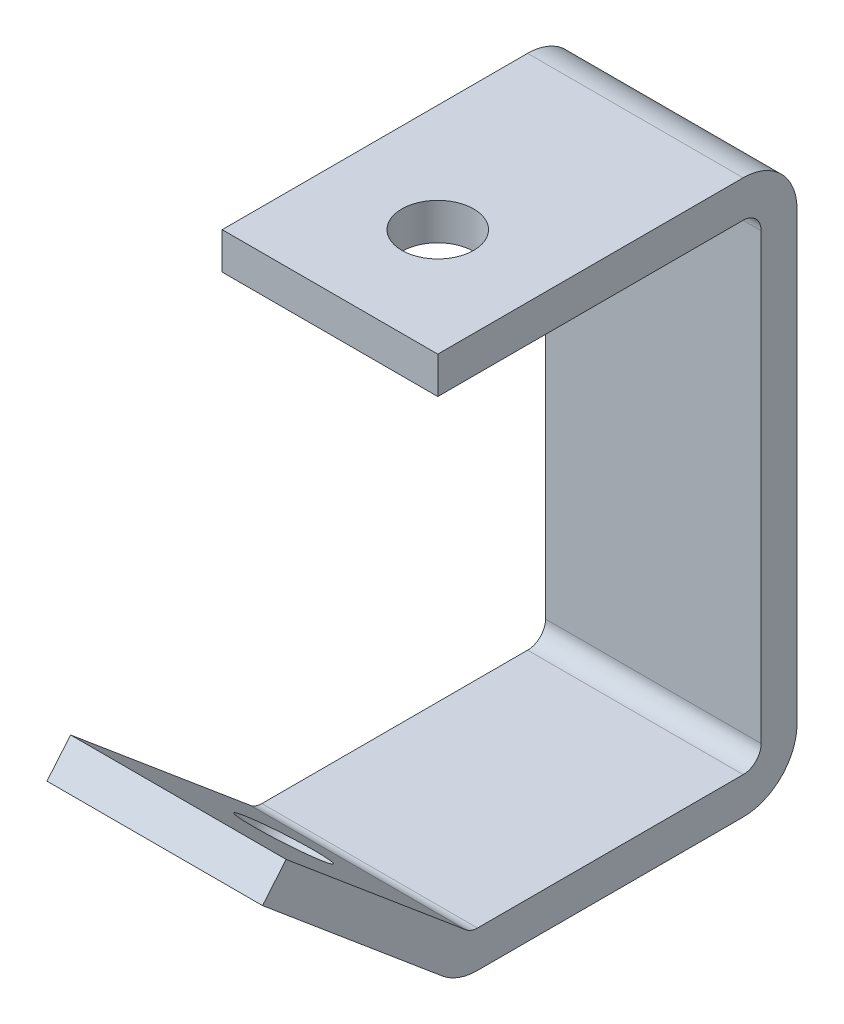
SolidWorks part; units mm, degrees
ref_plane "Ebene vorne" through (0, 0, 0) normal (0, 0, 1) x (1, 0, 0)
ref_plane "Ebene oben" through (0, 0, 0) normal (0, 1, 0) x (1, 0, 0)
ref_plane "Ebene rechts" through (0, 0, 0) normal (1, 0, 0) x (0, 0, -1)
ref_plane "Ebene1" through (19.05, 0, 0) normal (1, 0, 0) x (0, 0, -1)
sketch "Skizze1" plane through (19.05, 0, 0) normal (1, 0, 0) x (0, 0, -1)
  line L0 (6.35, -6.5) -> (6.35, 0)
  line L1 (6.35, 0) -> (-51.2842, 0)
  line L2 (-51.2842, 0) -> (-83.9439, 27.4047)
  line L3 (-83.9439, 27.4047) -> (-88.122, 22.4254)
  line L4 (-88.122, 22.4254) -> (-53.65, -6.5)
  line L5 (-53.65, -6.5) -> (6.35, -6.5)
  dimension "D1" = 6.5
  dimension "D2" = 140
  dimension "D3" = 60
  dimension "D4" = 6.35
  dimension "D5" = 45
extrude "Linear austragen1" add sketch "Skizze1" against normal blind 38.1
sketch "Skizze2" plane through (0, 0, 0) normal (0, 1, 0) x (-1, 0, 0)
  line L0 (-19.05, 0) -> (19.05, 0)
  line L1 (19.05, 0) -> (19.05, -6.35)
  line L2 (19.05, -6.35) -> (-19.05, -6.35)
  line L3 (-19.05, -6.35) -> (-19.05, 0)
  line L4 (-19.05, 55) -> (-19.05, -55) construction
  line L5 (19.05, -6.35) -> (19.05, 51.2842) construction
  line L6 (19.05, -6.35) -> (-19.05, -6.35) construction
extrude "Linear austragen2" add sketch "Skizze2" along normal blind 91.35
sketch "Skizze3" plane through (0, 0, 0) normal (0, 0, 1) x (1, 0, 0)
  line L0 (19.05, 84.85) -> (-19.05, 84.85)
  line L1 (-19.05, 84.85) -> (-19.05, 91.35)
  line L2 (-19.05, 91.35) -> (19.05, 91.35)
  line L3 (19.05, 91.35) -> (19.05, 84.85)
  line L4 (-19.05, 91.35) -> (19.05, 91.35) construction
  line L5 (19.05, 91.35) -> (19.05, 0) construction
  line L6 (-19.05, 91.35) -> (-19.05, 0) construction
  dimension "D1" = 6.5
extrude "Linear austragen3" add sketch "Skizze3" along normal blind 57.15
hole_wizard "Ø12.8 (12.8) Durchmesser Bohrung2" positions "Skizze8" profile "Skizze7" hole size "Ø12.8" standard "DIN"
sketch "Skizze8" plane through (0, 91.35, 0) normal (0, 1, 0) x (-1, 0, 0)
  line L0 (-19.05, 57.15) -> (19.05, 57.15) construction
  line L2 (0, 0) -> (0, 62.8105) construction
  point P0 (0, 38.1)
  dimension "D1" = 19.05
sketch "Skizze7" plane through (0, 91.35, 38.1) normal (1, 0, 0) x (0, 0, 1)
  line L0 (0, 0) -> (0, 6.5)
  line L1 (0, 6.5) -> (6.35, 6.5)
  line L2 (6.35, 6.5) -> (6.35, 0)
  line L5 (6.35, 0) -> (0, 0)
  line L11 (0, -6.35) -> (0, 107.95) construction
  dimension "Bohrerdurchmesser" = 12.7
  dimension "Bohrungstiefe" = 6.5
fillet "Verrundung1" radius 3.175 1 edges at (0, 84.85, 0)
fillet "Verrundung2" radius 3.175 1 edges at (0, 0, 51.2842)
fillet "Verrundung3" radius 3.175 1 edges at (0, 0, 0)
fillet "Verrundung4" radius 9.525 1 edges at (0, -6.5, -6.35)
fillet "Verrundung5" radius 9.525 1 edges at (0, 91.35, -6.35)
fillet "Verrundung6" radius 9.525 1 edges at (0, -6.5, 53.65)
sketch "Skizze9" plane through (0, -30.2318, 25.3675) normal (0, -0.766, 0.6428) x (1, 0, 0)
  circle A2 centre (0, 57.6296) radius 7
  circle A3 centre (0, 57.6296) radius 7
  dimension "D1" = 1
extrude "Schnitt-Linear austragen1" cut sketch "Skizze9" against normal up to next
